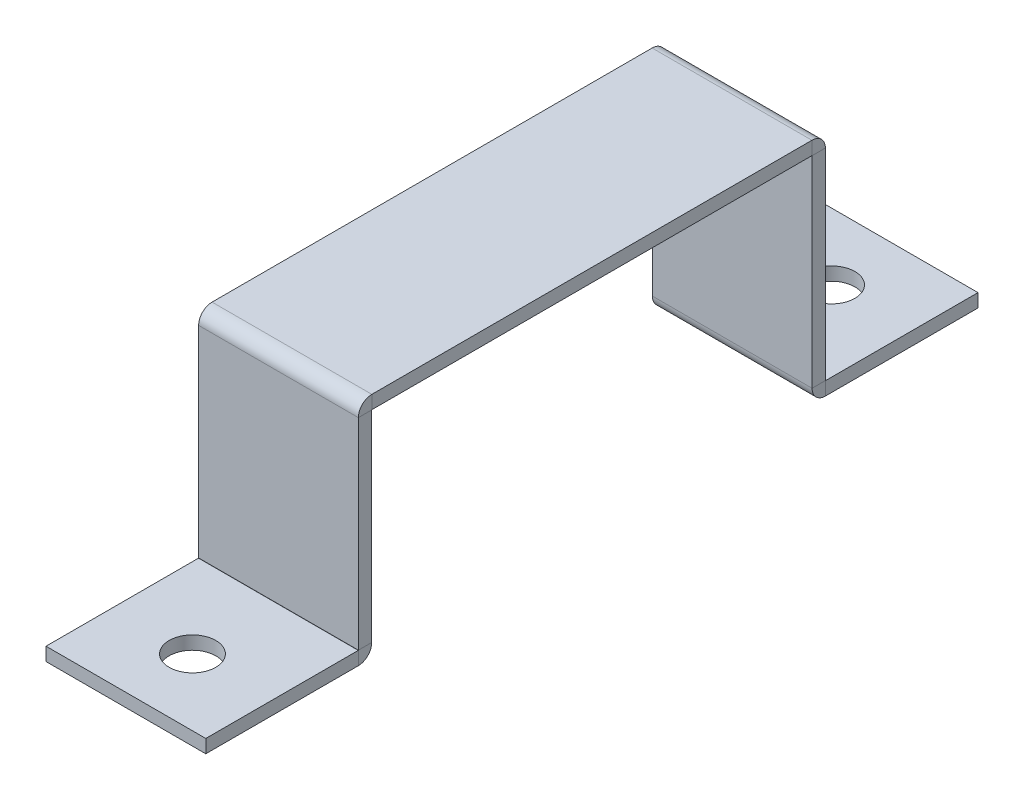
SolidWorks part; units mm, degrees
ref_plane "Front" through (0, 0, 0) normal (0, 0, 1) x (1, 0, 0)
ref_plane "Top" through (0, 0, 0) normal (0, 1, 0) x (1, 0, 0)
ref_plane "Right" through (0, 0, 0) normal (1, 0, 0) x (0, 0, -1)
sketch "Sketch1" plane through (0, 0, 0) normal (0, 1, 0) x (1, 0, 0)
  line L1 (0, 0) -> (12, 0)
  line L2 (0, 0) -> (0, 90)
  line L3 (0, 90) -> (12, 90)
  line L4 (12, 0) -> (12, 90)
  circle A0 centre (6, 85) radius 1.75
  circle A1 centre (6, 5) radius 1.75
sheet metal parameters "Sheet-Metal1" thickness 1 parameters "D1"=0.01
base flange "Base-Flange1" sketch "Sketch1" thickness 1 reverse thickness direction yes parameters "D1"=0.01
sketch "Sketch3" plane through (0, 1, 0) normal (0, 1, 0) x (-1, 0, 0)
  line L5 (-12, -62) -> (0, -62)
  line L6 (-12, -28) -> (0, -28)
sketched bend "Sketched Bend8" parameters "D1"=0
bend "SketchBend9" bend radius 0.01 bend angle 90 parameters "D5"=1
bend "SketchBend10" bend radius 0.01 bend angle 90 parameters "D5"=2
sketch "Sketch5" plane through (0, 0, -27.4636) normal (0, 0, 1) x (1, 0, 0)
  line L1 (0, -15.6094) -> (12, -15.6094)
sketched bend "Sketched Bend9" parameters "D1"=0.01
bend "SketchBend11" bend radius 0.01 bend angle 90 parameters "D5"=3
sketch "Sketch6" plane through (0, 0, -62.5364) normal (0, 0, -1) x (-1, 0, 0)
  line L1 (-12, -15.6094) -> (0, -15.6094)
sketched bend "Sketched Bend10" parameters "D1"=0.01
bend "SketchBend12" bend radius 0.01 bend angle 90 parameters "D5"=4
flat pattern "Flat-Pattern1"
sketch "Bend-Lines1" plane through (0, 1, 0) normal (0, 1, 0) x (-1, 0, 0)
  line L0 (-12, -78.073) -> (0, -78.073) construction
  line L1 (0, -11.927) -> (-12, -11.927) construction
  line L2 (-12, -28) -> (0, -28) construction
  line L3 (-12, -62) -> (0, -62) construction
bend of the flat pattern "Flatten-<SketchBend9>1"
bend of the flat pattern "Flatten-<SketchBend10>1"
bend of the flat pattern "Flatten-<SketchBend11>1"
bend of the flat pattern "Flatten-<SketchBend12>1"
